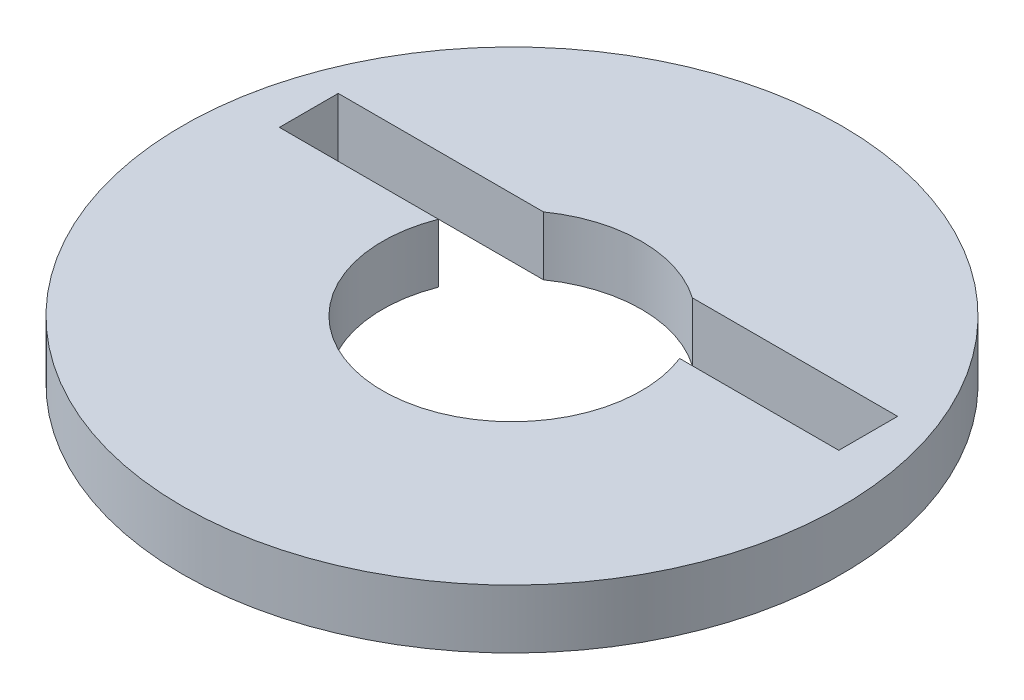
SolidWorks part; units mm, degrees
ref_plane "Front Plane" through (0, 0, 0) normal (0, 0, 1) x (1, 0, 0)
ref_plane "Top Plane" through (0, 0, 0) normal (0, 1, 0) x (1, 0, 0)
ref_plane "Right Plane" through (0, 0, 0) normal (1, 0, 0) x (0, 0, -1)
sketch "Sketch1" plane through (0, 0, 0) normal (0, 1, 0) x (1, 0, 0)
  circle A0 centre (0, 0) radius 17.78
extrude "Boss-Extrude1" add sketch "Sketch1" along normal blind 3.175
sketch "Sketch2" plane through (0, 3.175, 0) normal (0, 1, 0) x (1, 0, 0)
  line L0 (0, 17.78) -> (0, -17.78) construction
  line L2 (-15.0899, 2.54) -> (15.0899, 2.54)
  line L3 (-15.0899, 2.54) -> (-15.0899, 5.715)
  line L4 (-15.0899, 5.715) -> (15.0899, 5.715)
  line L5 (15.0899, 2.54) -> (15.0899, 5.715)
  line L6 (-15.0899, 2.54) -> (15.0899, 5.715) construction
  line L7 (-15.0899, 5.715) -> (15.0899, 2.54) construction
  circle A0 centre (0, 0) radius 17.78 construction
  point P5 (0, 4.1275)
extrude "Cut-Extrude1" cut sketch "Sketch2" against normal through all
sketch "Sketch3" plane through (0, 3.175, 0) normal (0, 1, 0) x (1, 0, 0)
  circle A0 centre (0, 0) radius 6.985
  dimension "D1" = 13.97
extrude "Cut-Extrude2" cut sketch "Sketch3" against normal through all
sketch "Sketch4" plane through (0, 3.175, 0) normal (0, 1, 0) x (1, 0, 0)
  line L12 (14.8359, 5.461) -> (3.935, 5.461)
  line L13 (14.8359, 2.794) -> (14.8359, 5.461)
  line L14 (6.1237, 2.794) -> (14.8359, 2.794)
  line L15 (-14.8359, 2.794) -> (-6.1237, 2.794)
  line L16 (-14.8359, 5.461) -> (-14.8359, 2.794)
  line L17 (-3.935, 5.461) -> (-14.8359, 5.461)
  line L18 (14.8359, 5.461) -> (3.935, 5.461)
  line L19 (14.8359, 2.794) -> (14.8359, 5.461)
  line L20 (6.1237, 2.794) -> (14.8359, 2.794)
  line L21 (-14.8359, 2.794) -> (-6.1237, 2.794)
  line L22 (-14.8359, 5.461) -> (-14.8359, 2.794)
  line L23 (-3.935, 5.461) -> (-14.8359, 5.461)
  circle A2 centre (0, 0) radius 18.034
  circle A3 centre (0, 0) radius 18.034
  arc A7 (-6.1237, 2.794) -> (6.1237, 2.794) centre (0, 0) ccw
  arc A8 (3.935, 5.461) -> (-3.935, 5.461) centre (0, 0) ccw
  arc A9 (-6.1237, 2.794) -> (6.1237, 2.794) centre (0, 0) ccw
  arc A10 (3.935, 5.461) -> (-3.935, 5.461) centre (0, 0) ccw
  dimension "D1" = 0.254
  dimension "D2" = 0.254
equation "\"t\"= .125in"
equation "\"Db\"= 1.40in"
equation "\"dc\"= .1in"
equation "\"ce\"= .04in"
equation "\"BaseDiameter@Sketch1\"= \"Db\""
equation "\"DistFromCenter@Sketch2\" = \"dc\""
equation "\"D1@Boss-Extrude1\"= \"t\""
equation "\"Thickness@Sketch2\"= \"t\""
equation "\"UprightWidth@Sketch2\"= 2 * sqr ( ( \"Db\" / 2 - \"ce\" ) ^ 2 - ( \"dc\" + 1.5 * \"t\" ) ^ 2 )"
